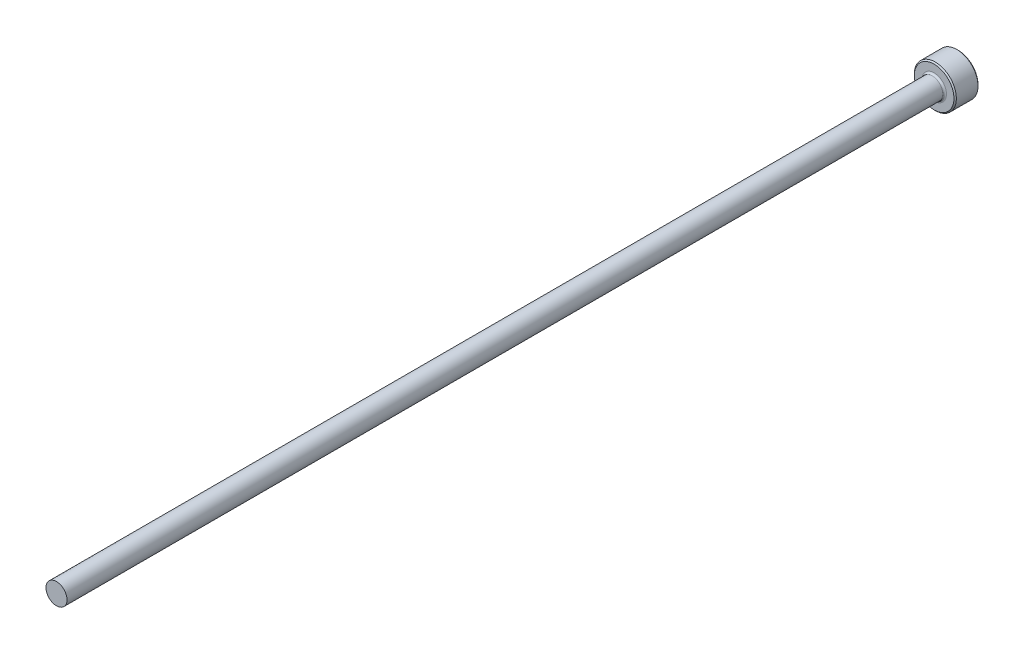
SolidWorks part; units mm, degrees
ref_plane "Front Plane" through (0, 0, 0) normal (0, 0, 1) x (1, 0, 0)
ref_plane "Top Plane" through (0, 0, 0) normal (0, 1, 0) x (1, 0, 0)
ref_plane "Right Plane" through (0, 0, 0) normal (1, 0, 0) x (0, 0, -1)
sketch "Sketch1" plane through (0, 0, 0) normal (1, 0, 0) x (0, 0, -1)
  line L0 (0, 0) -> (0, 3.5)
  line L1 (0, 3.85) -> (0, -3.85) construction
  line L2 (0, 3.5) -> (-4, 3.5)
  line L3 (-4, 3.5) -> (-4, 2.05)
  line L4 (-4.3, 1.75) -> (-150, 1.75)
  line L5 (-150, 1.75) -> (-150, 0)
  line L6 (3.85, 0) -> (-3.85, 0) construction
  line L7 (-150, 0) -> (0, 0)
  line L8 (-109.0506, 0) -> (16.9928, 0) construction
  arc A0 (-4, 2.05) -> (-4.3, 1.75) centre (-4.3, 2.05) cw
  dimension "D1" = 0.3
  dimension "D2" = 7
  dimension "D3" = 3.5
  dimension "D4" = 150
  dimension "D5" = 4
revolve "Revolve1" add sketch "Sketch1" angle 360 about L8
chamfer "Chamfer1" distance 0.2 angle 45 2 edges at (3.5, 0, 0) (3.5, 0, 4)
